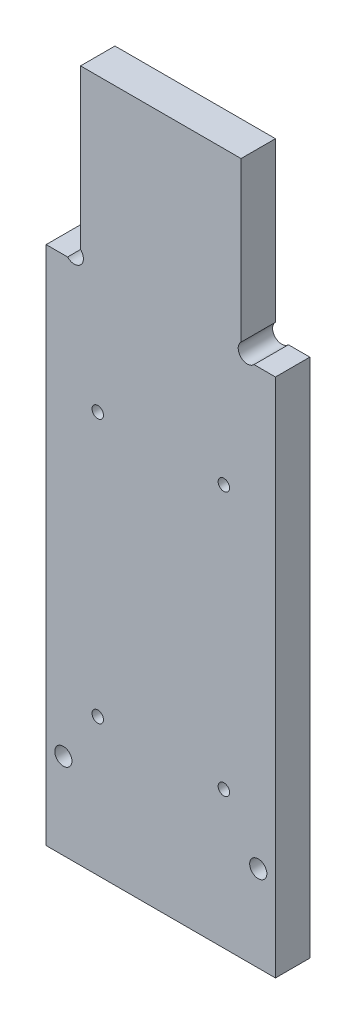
SolidWorks part; units mm, degrees
ref_plane "Face" through (0, 0, 0) normal (0, 0, 1) x (1, 0, 0)
ref_plane "Dessus" through (0, 0, 0) normal (0, 1, 0) x (1, 0, 0)
ref_plane "Droite" through (0, 0, 0) normal (1, 0, 0) x (0, 0, -1)
sketch "Esquisse1" plane through (0, 0, 0) normal (0, 0, 1) x (1, 0, 0)
  line L1 (-60.9184, 49.4675) -> (-20.9184, 49.4675)
  line L2 (-60.9184, 49.4675) -> (-60.9184, -71.3325)
  line L3 (-60.9184, -71.3325) -> (-20.9184, -71.3325)
  line L4 (-20.9184, 49.4675) -> (-20.9184, -71.3325)
  dimension "D1" = 40
  dimension "D2" = 120.8
extrude "Base-Extrusion" add sketch "Esquisse1" along normal blind 6
sketch "Esquisse3" plane through (0, 0, 6) normal (0, 0, 1) x (1, 0, 0)
  line L1 (-60.9184, 49.4675) -> (-54.9184, 49.4675)
  line L2 (-60.9184, 49.4675) -> (-60.9184, 19.4675)
  line L3 (-60.9184, 19.4675) -> (-54.9184, 19.4675)
  line L4 (-54.9184, 49.4675) -> (-54.9184, 19.4675)
  line L5 (-20.9184, 49.4675) -> (-26.9184, 49.4675)
  line L6 (-20.9184, 49.4675) -> (-20.9184, 19.4675)
  line L7 (-20.9184, 19.4675) -> (-26.9184, 19.4675)
  line L8 (-26.9184, 49.4675) -> (-26.9184, 19.4675)
  dimension "D1" = 6
  dimension "D2" = 6
  dimension "D3" = 30
  dimension "D4" = 30
extrude "Enlèv. mat.-Extru.2" cut sketch "Esquisse3" against normal up to vertex (6 mm away)
sketch "Esquisse2" plane through (0, 0, 6) normal (0, 0, 1) x (1, 0, 0)
  line L0 (-60.9184, -71.3325) -> (-20.9184, -71.3325) construction
  line L1 (-60.9184, 19.4675) -> (-60.9184, -71.3325) construction
  line L2 (-20.9184, -71.3325) -> (-20.9184, 19.4675) construction
  circle A0 centre (-23.9184, -56.3325) radius 1.5
  circle A1 centre (-57.9184, -56.3325) radius 1.5
  dimension "D3" = 3
  dimension "D4" = 3
  dimension "D1" = 15
  dimension "D2" = 15
  dimension "D5" = 3
  dimension "D6" = 3
extrude "Enlèv. mat.-Extru.1" cut sketch "Esquisse2" against normal up to vertex (6 mm away)
sketch "Esquisse5" plane through (0, 0, 6) normal (0, 0, 1) x (1, 0, 0)
  line L0 (-26.9184, 49.4675) -> (-26.9184, 19.4675) construction
  line L1 (-54.9184, 19.4675) -> (-54.9184, 49.4675) construction
  line L2 (-60.9184, 19.4675) -> (-54.9184, 19.4675) construction
  line L3 (-26.9184, 19.4675) -> (-20.9184, 19.4675) construction
  circle A0 centre (-56.0184, 20.5675) radius 1.6
  circle A1 centre (-25.8184, 20.5675) radius 1.6
  dimension "D1" = 1.1
  dimension "D2" = 1.1
  dimension "D3" = 1.1
  dimension "D4" = 1.1
extrude "Enlèv. mat.-Extru.3" cut sketch "Esquisse5" against normal up to vertex (6 mm away)
sketch "Esquisse6" plane through (0, 0, 6) normal (0, 0, 1) x (1, 0, 0)
  line L0 (-20.9184, -71.3325) -> (-20.9184, 19.4675) construction
  line L1 (-60.9184, -71.3325) -> (-20.9184, -71.3325) construction
  circle A0 centre (-51.9184, -1.3325) radius 1
  circle A1 centre (-29.9184, -1.3325) radius 1
  circle A2 centre (-51.9184, -47.3325) radius 1
  circle A3 centre (-29.9184, -47.3325) radius 1
  dimension "D1" = 9
  dimension "D2" = 70
  dimension "D3" = 46
  dimension "D4" = 46
  dimension "D5" = 22
  dimension "D6" = 22
extrude "Enlèv. mat.-Extru.4" cut sketch "Esquisse6" against normal blind 5
